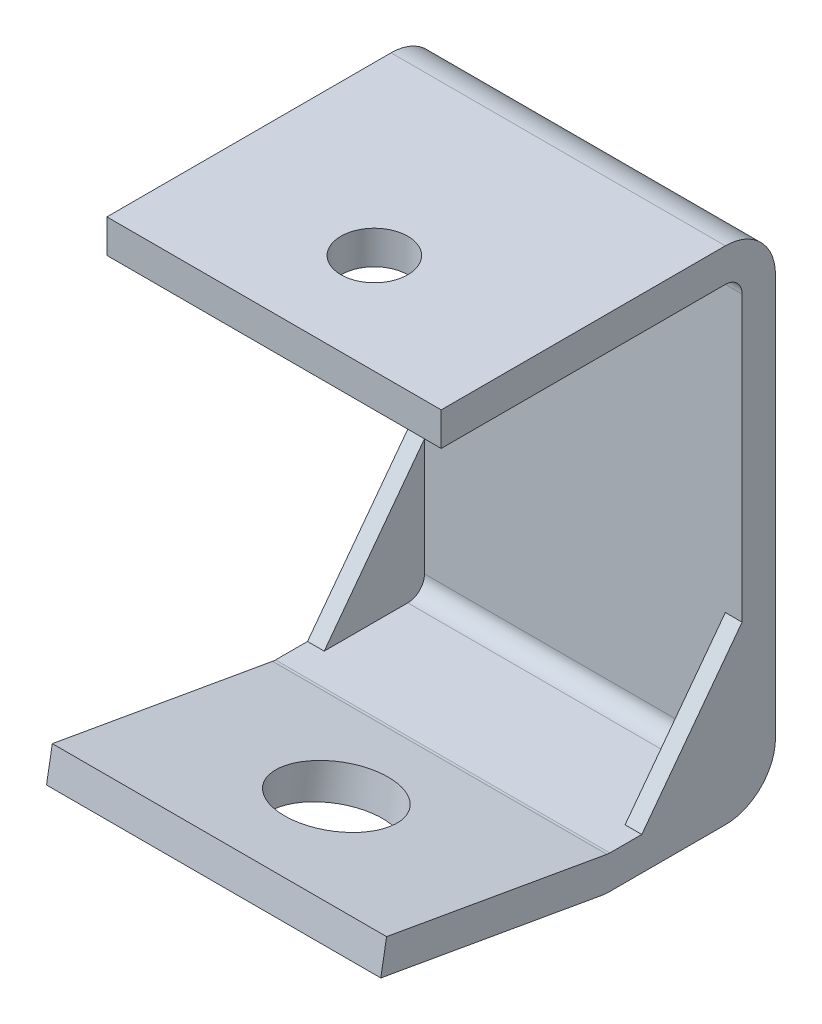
SolidWorks part; units mm, degrees
ref_plane "front" through (0, 0, 0) normal (0, 0, 1) x (1, 0, 0)
ref_plane "top" through (0, 0, 0) normal (0, 1, 0) x (1, 0, 0)
ref_plane "right" through (0, 0, 0) normal (1, 0, 0) x (0, 0, -1)
sketch "Sketch1" plane through (0, 0, 0) normal (1, 0, 0) x (0, 0, -1)
  line L0 (0, 0) -> (0, 82.55)
  line L1 (0, 82.55) -> (-57.15, 82.55)
  line L4 (-67.5238, 7.4276) -> (-25.4, 0)
  line L5 (-25.4, 0) -> (0, 0)
  dimension "D1" = 82.55
  dimension "D2" = 57.15
  dimension "D3" = 10
  dimension "D4" = 42.7736
  dimension "D5" = 25.4
extrude "Base-Extrude-Thin" add sketch "Sketch1" along normal mid plane 63.5 thin
sketch "Sketch2" plane through (0, 88.9, 0) normal (0, 1, 0) x (-1, 0, 0)
  line L0 (0, 50) -> (0, -50) construction
  line L1 (-31.75, 57.15) -> (31.75, 57.15) construction
  circle A0 centre (0, 38.1) radius 6.35
  dimension "D1" = 12.7
  dimension "D2" = 19.05
extrude "Cut-Extrude1" cut sketch "Sketch2" against normal up to next
sketch "Sketch3" plane through (31.75, 0, 0) normal (1, 0, 0) x (0, 0, -1)
  line L0 (-25.1222, 0) -> (-3.175, 0) construction
  line L1 (0, 3.175) -> (0, 79.375) construction
  line L2 (-19.05, 0) -> (-3.175, 0)
  line L3 (0, 3.175) -> (0, 25.4)
  line L4 (-19.05, 0) -> (0, 25.4)
  arc A0 (-3.175, 0) -> (0, 3.175) centre (-3.175, 3.175) ccw construction
  arc A1 (-3.175, 0) -> (0, 3.175) centre (-3.175, 3.175) ccw
  dimension "D1" = 25.4
  dimension "D2" = 19.05
extrude "Boss-Extrude1" add sketch "Sketch3" against normal blind 3.175
mirror "Mirror1" about plane through (0, 0, 0) normal (1, 0, 0) of "Boss-Extrude1"
sketch "Sketch4" plane through (0, -4.3437, 0.7659) normal (0, 0.9848, -0.1736) x (-1, 0, 0)
  circle A0 centre (0, 45.2398) radius 10 construction
  circle A1 centre (0, 45.2398) radius 10
extrude "Cut-Extrude2" cut sketch "Sketch4" against normal through all
